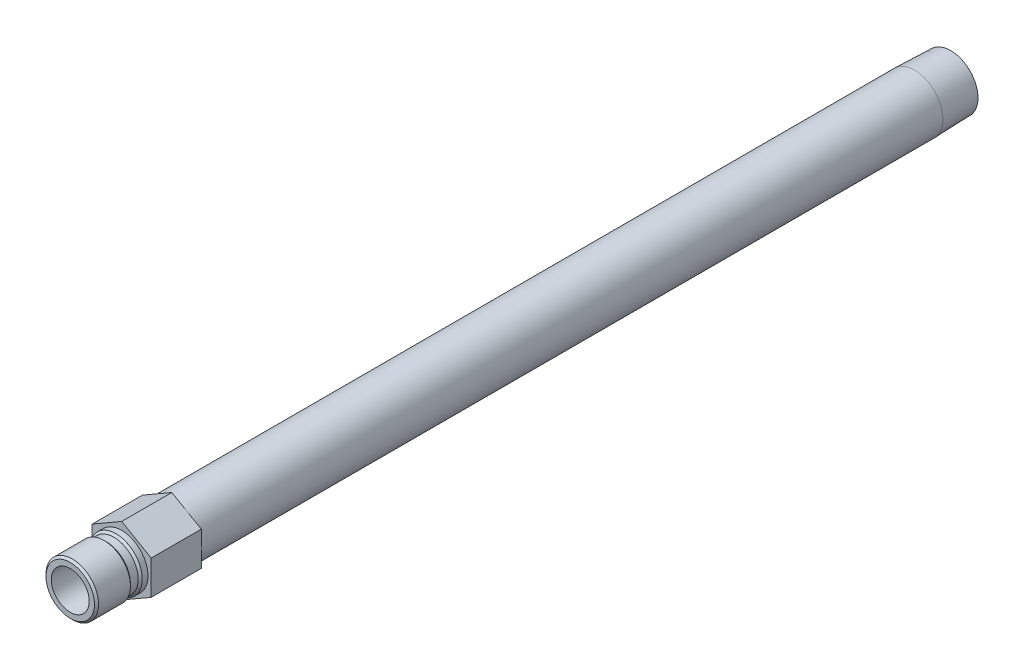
SolidWorks part; units mm, degrees
ref_plane "Front Plane" through (0, 0, 0) normal (0, 0, 1) x (1, 0, 0)
ref_plane "Top Plane" through (0, 0, 0) normal (0, 1, 0) x (1, 0, 0)
ref_plane "Right Plane" through (0, 0, 0) normal (1, 0, 0) x (0, 0, -1)
sketch "Sketch1" plane through (0, 0, 0) normal (1, 0, 0) x (0, 0, -1)
  line L0 (0, 0) -> (-22.479, 0) construction
  line L1 (-19.304, 7.112) -> (-19.304, 9.0932)
  line L2 (-5.8166, 9.0932) -> (-5.8166, 0) construction
  line L3 (-18.542, 9.8552) -> (-6.5786, 9.8552)
  line L4 (0, 10.668) -> (0, 0) construction
  line L5 (-5.8166, 9.0932) -> (-2.921, 9.0932)
  line L6 (-2.159, 9.8552) -> (0, 9.8552)
  line L7 (0, 9.8552) -> (0, 10.668)
  line L8 (-5.8166, 9.0932) -> (-6.5786, 9.8552)
  line L9 (-2.921, 9.0932) -> (-2.159, 9.8552)
  line L10 (-19.304, 9.0932) -> (-18.542, 9.8552)
  line L11 (-19.304, 7.112) -> (-1.524, 7.112)
  line L12 (0, 10.668) -> (297.3324, 10.668)
  line L13 (297.3324, 10.668) -> (310.896, 10.2441)
  line L14 (310.896, 10.2441) -> (310.896, 7.8994)
  line L15 (0, 9.8552) -> (18.796, 9.8552) construction
  line L16 (18.796, 9.8552) -> (18.796, 0) construction
  line L17 (18.796, 0) -> (0, 0) construction
  line L18 (-1.524, 7.112) -> (-1.1053, 7.8994)
  line L19 (-1.1053, 7.8994) -> (310.896, 7.8994)
  dimension "D1" = 19.304
  dimension "D2" = 2.8956
  dimension "D3" = 0.762
  dimension "D4" = 45
  dimension "D5" = 13.4874
  dimension "D6" = 45
  dimension "D7" = 1.79
  dimension "D8" = 13.5636
  dimension "D9" = 330.2
  dimension "D10" = 3.175
  dimension "D11" = 38.1
  dimension "D12" = 14.224
  dimension "D13" = 21.336
  dimension "D14" = 19.7104
  dimension "D15" = 15.7988
  dimension "D16" = 118
  dimension "D17" = 17.78
revolve "Revolve1" add sketch "Sketch1" angle 360 about L0
sketch "Sketch2" plane through (0, 0, 0) normal (0, 0, 1) x (1, 0, 0)
  line L1 (-11.049, 6.3791) -> (-11.049, -6.3791)
  line L2 (-11.049, -6.3791) -> (0, -12.7583)
  line L3 (0, -12.7583) -> (11.049, -6.3791)
  line L4 (11.049, -6.3791) -> (11.049, 6.3791)
  line L5 (11.049, 6.3791) -> (0, 12.7583)
  line L6 (0, 12.7583) -> (-11.049, 6.3791)
  circle A0 centre (0, 0) radius 11.049 construction
  circle A1 centre (0, 0) radius 7.112 construction
  circle A2 centre (0, 0) radius 7.112
  dimension "D1" = 22.098
extrude "Boss-Extrude1" add sketch "Sketch2" against normal up to vertex (18.796 mm away) from vertex at 0
